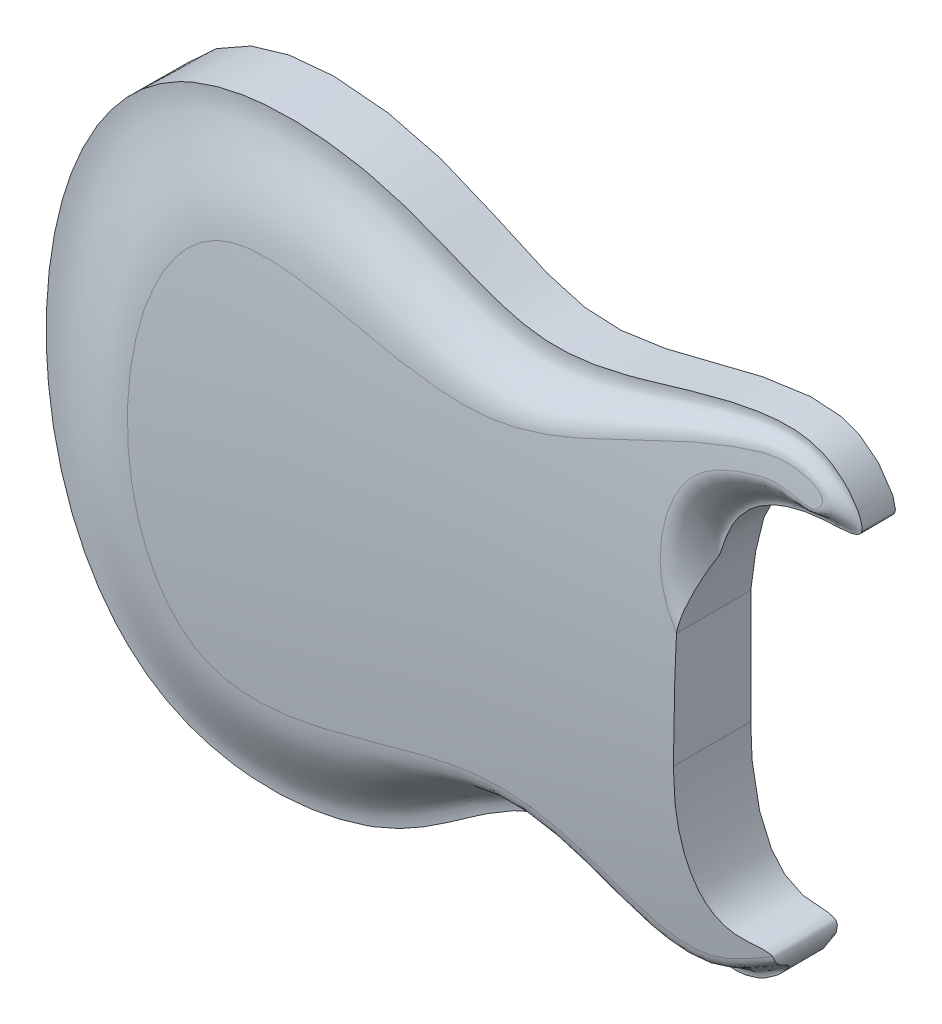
SolidWorks part; units mm, degrees
ref_plane "Front Plane" through (0, 0, 0) normal (0, 0, 1) x (1, 0, 0)
ref_plane "Top Plane" through (0, 0, 0) normal (0, 1, 0) x (1, 0, 0)
ref_plane "Right Plane" through (0, 0, 0) normal (1, 0, 0) x (0, 0, -1)
sketch "Sketch1" plane through (0, 0, 0) normal (0, 1, 0) x (1, 0, 0)
  line L0 (-380.9748, -51.9303) -> (97.4564, -30.6197) construction
  line L2 (-195.3345, 0) -> (195.3345, 0) construction
  line L3 (-592.5941, 1082.777) -> (269.486, 1121.1762) construction
  arc A0 (-380.9748, -51.9303) -> (97.4564, -30.6197) centre (-241.9267, 2207.5326) ccw
  point P2 (72.0815, -31.75)
  point P5 (-355.6, -50.8)
  dimension "D1" = 25.4
  dimension "D2" = 25.4
  dimension "D3" = 30.6197
  dimension "D4" = 97.4564
  dimension "D5" = 2.55
  dimension "D6" = 478.4312
  dimension "D7" = 12.7
  dimension "D8" = 1143
surface "Surface-Revolve1" sketch "Sketch1" parameters "D1"=30
ref_plane "Angled Plane" through (1.5542, 0, 34.8915) normal (0.0445, 0, 0.999) x (0.999, 0, -0.0445)
ref_plane "Plane1" through (0.989, 0, 22.204) normal (0.0445, 0, 0.999) x (0.999, 0, -0.0445)
sketch "Sketch2" plane through (-96.4883, 26.5703, 0) normal (0, 0, 1) x (1, 0, 0)
  line L1 (95.7101, 5.1797) -> (-196.7425, 5.1797) construction
  line L2 (-153.235, 105.762) -> (-153.235, -95.4025) construction
  line L3 (-65.0331, -89.9675) -> (-65.0331, 100.327) construction
  line L4 (-196.7425, 5.1797) -> (-260.2425, 5.1797) construction
  spline S0 degree 3 poles (207.7093, -26.5703) (148.9299, -5.4191) (71.935, 22.2868) (91.5633, 113.7917) (123.9586, 123.4584) (142.7496, 125.8642) (158.7707, 116.9684) (163.7795, 128.6124) (145.0344, 136.8672) (122.7071, 134.0197) (72.0163, 118.2186) (10.7256, 85.4574) (-70.8597, 100.4467) (-171.2577, 127.8192) (-210.7031, 4.9736) (-171.2932, -116.7149) (-66.5757, -90.9043) (-1.1762, -72.3825) (57.9574, -91.1798) (97.6769, -120.898) (155.3598, -95.4036) (183.8897, -70.5749) (207.7093, -49.8455) knots 0 0 0 0 0.128417 0.168213 0.191991 0.205462 0.220099 0.221295 0.235526 0.252941 0.284296 0.364515 0.419541 0.493426 0.585025 0.676623 0.750509 0.814713 0.847251 0.905045 0.920723 1 1 1 1
  dimension "D2" = 63.5
surface "Top Shape Trim"
sketch "Sketch3" plane through (0.989, 0, 22.204) normal (0.0445, 0, 0.999) x (0.999, 0, -0.0445)
  line L2 (29.1269, -97.8003) -> (104.2908, -52.1742) construction
  spline S1 degree 3 number of poles 252 (29.1269, -97.8003) -> (76.5867, 152.7438) construction
  spline S2 degree 3 number of poles 304 (110.6938, 8.1763) -> (104.2908, -52.1742)
  spline S3 degree 3 poles (76.5867, 152.7438) (77.0116, 152.023) (77.4158, 151.288) (78.1933, 149.7377) (78.5639, 148.9193) (79.2069, 147.255) (79.4824, 146.4068) (79.7761, 145.0925) (79.8529, 144.6501) (79.923, 143.9829) (79.9388, 143.7596) (79.9519, 143.3111) (79.9492, 143.0852) (79.9071, 142.4148) (79.8353, 141.9747) (79.5574, 141.1152) (79.3552, 140.7152) (78.8011, 139.9986) (78.4665, 139.6994) (77.7203, 139.1896) (77.3227, 138.9873) (76.4981, 138.6462) (76.0681, 138.5075) (75.2059, 138.2775) (74.7724, 138.1854) (73.467, 137.9542) (72.5904, 137.8587) (70.8312, 137.7244) (69.9485, 137.6867) (67.2957, 137.6172) (65.5204, 137.6282) (61.9713, 137.6325) (60.198, 137.626) (54.9028, 137.4324) (51.4013, 137.1025) (44.4679, 135.955) (41.0357, 135.1388) (36.8018, 133.7239) (35.9578, 133.4209) (34.2761, 132.7717) (33.4415, 132.4266) (30.978, 131.3356) (29.3812, 130.5312) (26.2852, 128.7568) (24.7861, 127.7868) (22.6175, 126.196) (21.908, 125.6431) (20.5172, 124.4895) (19.839, 123.8913) (17.8754, 122.0484) (16.6527, 120.7495) (14.3794, 118.0118) (13.3299, 116.572) (11.8745, 114.3155) (11.4091, 113.5472) (10.5158, 111.9803) (10.0891, 111.1837) (8.8743, 108.7783) (8.1462, 107.1459) (6.6995, 103.5299) (6.0067, 101.5373) (5.3859, 99.5193) knots 0.896592 0.896592 0.896592 0.896592 0.898438 0.898438 0.900391 0.900391 0.902344 0.902344 0.90332 0.90332 0.903809 0.903809 0.904297 0.904297 0.905273 0.905273 0.90625 0.90625 0.907227 0.907227 0.908203 0.908203 0.90918 0.90918 0.910156 0.910156 0.912109 0.912109 0.914063 0.914063 0.917969 0.917969 0.921875 0.921875 0.929688 0.929688 0.9375 0.9375 0.939453 0.939453 0.941406 0.941406 0.945313 0.945313 0.949219 0.949219 0.951172 0.951172 0.953125 0.953125 0.957031 0.957031 0.960938 0.960938 0.962891 0.962891 0.964844 0.964844 0.96875 0.96875 0.973375 0.973375 0.973375 0.973375 construction
  spline S4 degree 3 poles (5.3859, 99.5193) (3.3161, 93.0347) (11.5035, 51.9374) (81.5334, 21.0414) (110.6938, 8.1763) knots 0 0 0 0 0.583601 1 1 1 1 construction
sketch "Sketch4" plane through (0.989, 0, 22.204) normal (0.0445, 0, 0.999) x (0.999, 0, -0.0445)
  line L5 (110.6938, 8.1763) -> (104.2908, -52.1742)
  spline S0 degree 3 number of poles 304 (110.6938, 8.1763) -> (104.2908, -52.1742) construction
  spline S1 degree 3 number of poles 304 (110.6938, 8.1763) -> (104.2908, -52.1742)
surface "Construction Surface for Loft" sketch "Sketch4"
surface "Shape Loft"
delete or keep bodies "Body-Delete1" type delete bodies bodies 139
surface "Surface-Extend1" parameters "D1"=1.778
surface "Top Surface Knit"
sketch "Guitar Body Outline" plane through (0, 0, 0) normal (0, 0, 1) x (1, 0, 0)
  line L0 (0, 63.5) -> (0, 0)
  line L1 (0, 31.75) -> (-355.6, 31.75) construction
  line L2 (-286.0579, 184.15) -> (-286.0579, -120.65) construction
  line L3 (-163.7965, -118.8493) -> (-163.7965, 182.3493) construction
  spline S0 degree 3 poles (0, 63.5) (2.4707, 84.1763) (7.034, 122.3646) (46.8232, 139.9004) (87.3467, 136.0004) (67.0488, 173.6245) (2.0345, 177.7665) (-80.1818, 134.4451) (-173.9531, 195.6953) (-316.8898, 206.98) (-377.6823, 30.9941) (-317.9087, -140.8648) (-165.327, -137.5991) (-100.749, -67.3623) (-28.9342, -80.403) (20.3895, -123.3517) (55.7195, -68.503) (16.231, -73.6373) (1.1604, -36.0474) (0, -10.747) (0, 0) knots 0 0 0 0 0.044035 0.081332 0.096422 0.112661 0.147802 0.24108 0.300473 0.394246 0.522717 0.651187 0.744961 0.816316 0.847087 0.908535 0.926631 0.938591 0.975274 1 1 1 1
  dimension "D1" = 228.6
  dimension "D2" = 355.6
  dimension "D3" = 304.8
  dimension "D4" = 63.5
  dimension "D5" = 69.5421
extrude "Boss-Extrude1" add sketch "Guitar Body Outline" along normal blind 50.8 contours S0 L0
other "Replace Face1"
